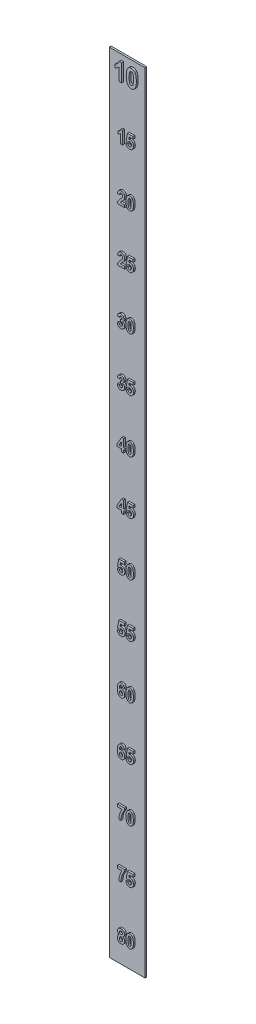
SolidWorks part; units mm, degrees
ref_plane "Plan de face" through (0, 0, 0) normal (0, 0, 1) x (1, 0, 0)
ref_plane "Plan de dessus" through (0, 0, 0) normal (0, 1, 0) x (1, 0, 0)
ref_plane "Plan de droite" through (0, 0, 0) normal (1, 0, 0) x (0, 0, -1)
imported_body "Importée1"
other "Enlèv. mat.-Extru.3"
